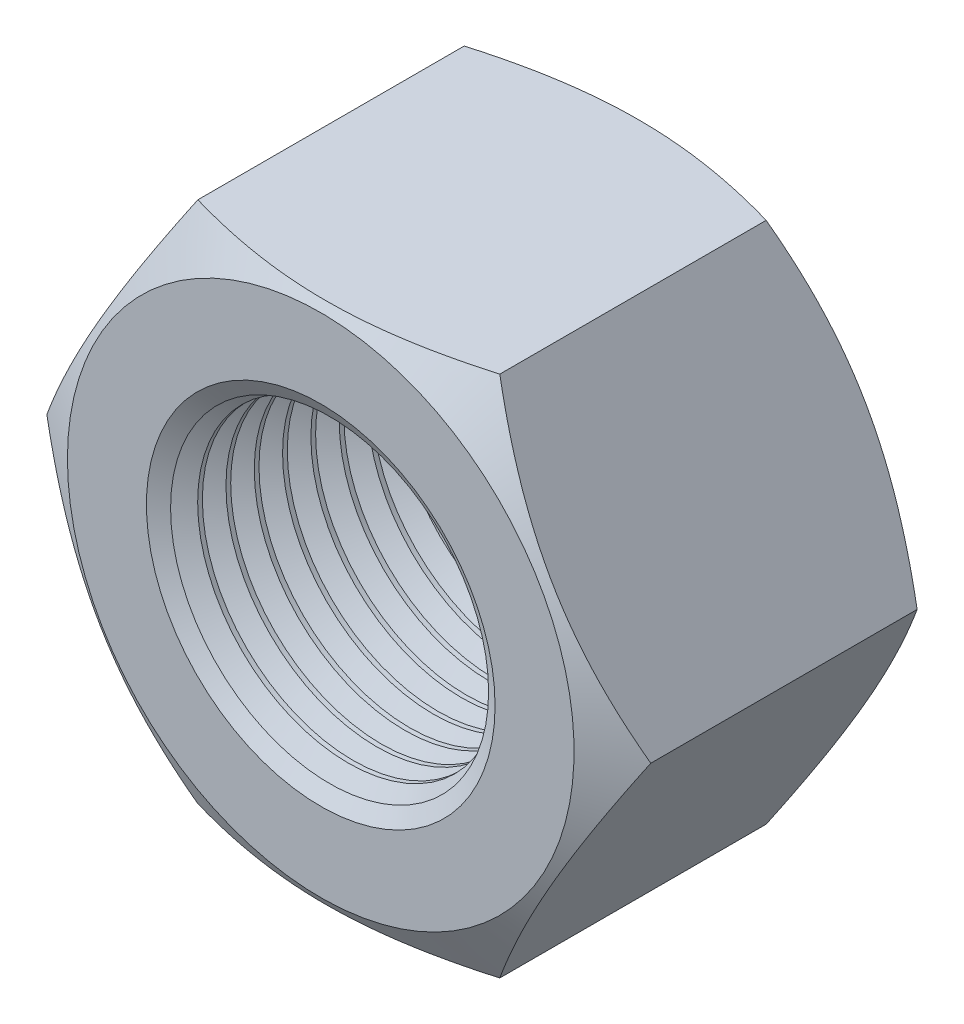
SolidWorks part; units mm, degrees
ref_plane "Front" through (0, 0, 0) normal (0, 0, 1) x (1, 0, 0)
ref_plane "Top" through (0, 0, 0) normal (0, 1, 0) x (1, 0, 0)
ref_plane "Right" through (0, 0, 0) normal (1, 0, 0) x (0, 0, -1)
other "Configuration Table"
sketch "Sketch1" plane through (0, 0, 0) normal (0, 0, 1) x (1, 0, 0)
  line L1 (13.8564, 0) -> (6.9282, 12)
  line L2 (6.9282, 12) -> (-6.9282, 12)
  line L3 (-6.9282, 12) -> (-13.8564, 0)
  line L4 (-13.8564, 0) -> (-6.9282, -12)
  line L5 (-6.9282, -12) -> (6.9282, -12)
  line L6 (6.9282, -12) -> (13.8564, 0)
  circle A0 centre (0, 0) radius 12 construction
  circle A1 centre (0, 0) radius 6.9175
extrude "BaseNut" add sketch "Sketch1" against normal blind 14.8
sketch "Sketch2" plane through (0, 0, 0) normal (0, 1, 0) x (1, 0, 0)
  line L0 (-13.8564, 14.8) -> (-11.625, 14.8)
  line L2 (-11.625, 14.8) -> (-13.8564, 13.5117)
  line L3 (-13.8564, 13.5117) -> (-13.8564, 14.8)
  line L4 (0, 3.3759) -> (0, -9.8171) construction
  line L6 (-9.7712, 7.4) -> (9.8853, 7.4) construction
  line L7 (-13.8564, 1.2883) -> (-13.8564, 0)
  line L8 (-11.625, 0) -> (-13.8564, 1.2883)
  line L9 (-13.8564, 0) -> (-11.625, 0)
revolve "Double-Chamfer" cut sketch "Sketch2" angle 360 about L4
chamfer "EndChamfer" distance 1.0825 angle 30 2 edges at (6.9175, 0, -14.8) (6.9175, 0, 0)
sketch "Sketch3" plane through (0, 0, 0) normal (0, 1, 0) x (1, 0, 0)
  line L0 (-7.855, 13.7175) -> (-6.9175, 13.1762)
  line L1 (-6.9175, 13.1762) -> (-5.835, 13.1762)
  line L2 (-5.835, 13.1762) -> (-5.835, 14.2587)
  line L3 (-5.835, 14.2587) -> (-6.9175, 14.2587)
  line L4 (-6.9175, 14.2587) -> (-7.855, 13.7175)
  line L5 (0, 7.4383) -> (0, 16.8806) construction
revolve "Cut-Revolve10" cut sketch "Sketch3" angle 360 about L5
pattern_linear "LPattern10" count 11 spacing 1.299 along (0, 0, 1) of "Cut-Revolve10"
equation "\"dw@Sketch2\" = \"s@Sketch1\"-0.75"
equation "\"D2@Sketch2\" = \"m@BaseNut\" / 2"
equation "\"D2@Sketch3\" = \"D@Sketch1\""
equation "\"D1@Sketch3\" =  (\"D@ThreadCosmetic1\"   - \"D@Sketch1\")  / 2"
equation "\"D3@LPattern10\" = \"D1@Sketch3\" * 1.2"
equation "\"D1@LPattern10\" = \"m@BaseNut\"/\"D3@LPattern10\""
